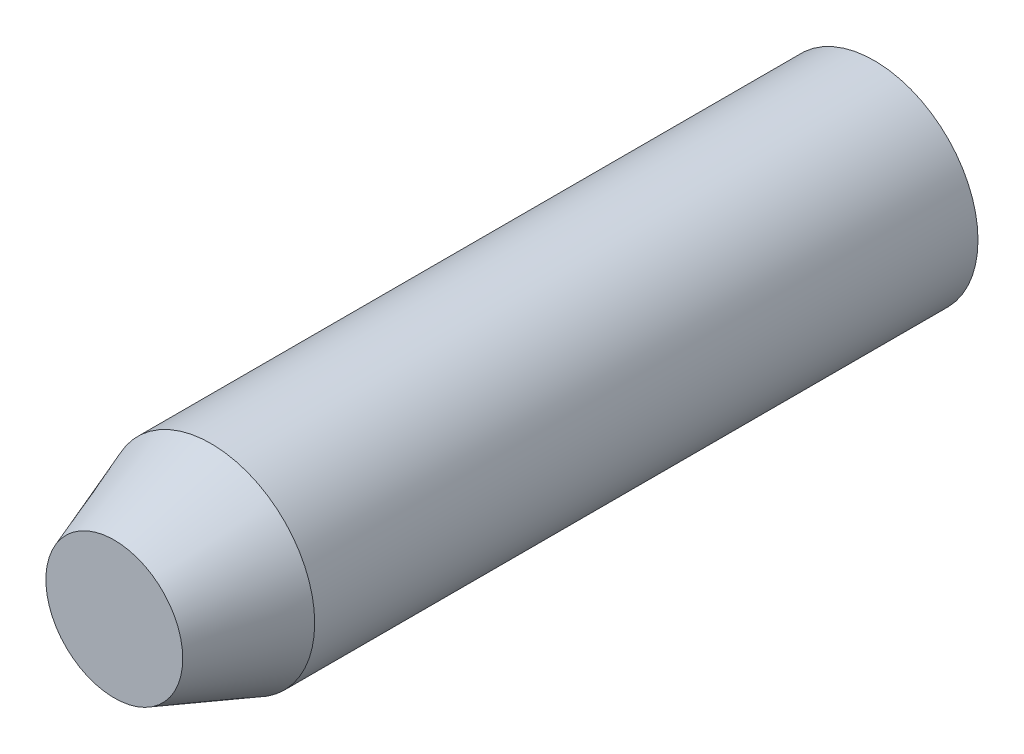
SolidWorks part; units mm, degrees
ref_plane "Plan de face" through (0, 0, 0) normal (0, 0, 1) x (1, 0, 0)
ref_plane "Plan de dessus" through (0, 0, 0) normal (0, 1, 0) x (1, 0, 0)
ref_plane "Plan de droite" through (0, 0, 0) normal (1, 0, 0) x (0, 0, -1)
sketch "Esquisse1" plane through (0, 0, 0) normal (0, 0, 1) x (1, 0, 0)
  circle A0 centre (0, 0) radius 1.5
  dimension "D1" = 3
extrude "Boss.-Extru.1" add sketch "Esquisse1" along normal blind 11
chamfer "Chanfrein1" distance 1.4 angle 20 1 edges at (1.5, 0, 11)
